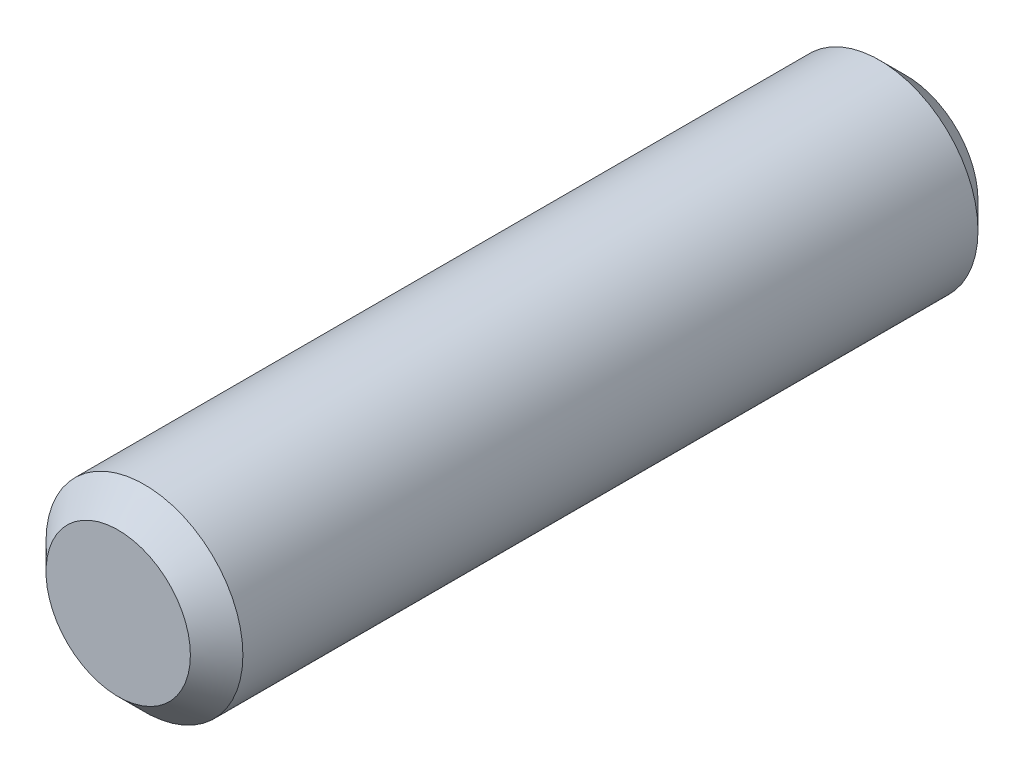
SolidWorks part; units mm, degrees
ref_plane "Plan1" through (0, 0, 0) normal (0, 0, 1) x (1, 0, 0)
ref_plane "Plan2" through (0, 0, 0) normal (0, 1, 0) x (1, 0, 0)
ref_plane "Plan3" through (0, 0, 0) normal (1, 0, 0) x (0, 0, -1)
sketch "Esquisse1" plane through (0, 0, 0) normal (0, 0, 1) x (1, 0, 0)
  circle A0 centre (0, 0) radius 7.5
  dimension "D1" = 15
extrude "Base-Extrusion" add sketch "Esquisse1" along normal mid plane 60
chamfer "Chanfrein1" distance 2 angle 45
